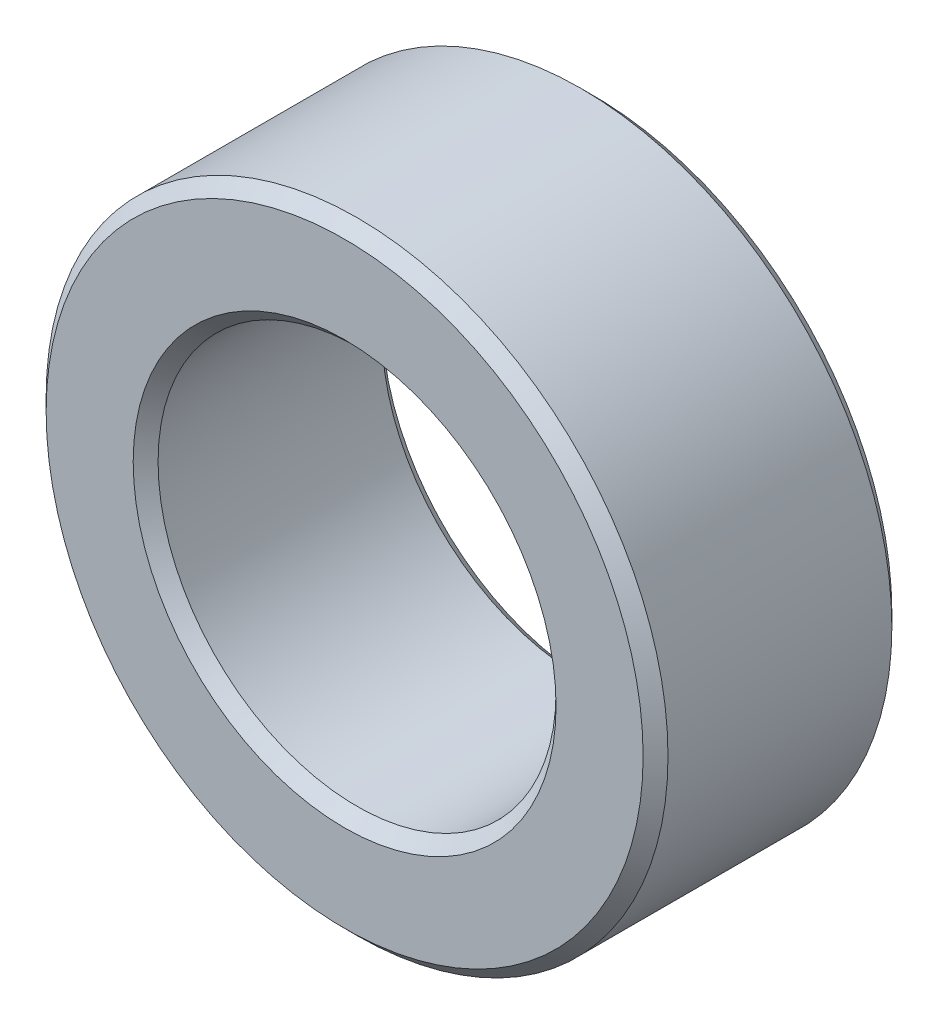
SolidWorks part; units mm, degrees
ref_plane "Front Plane" through (0, 0, 0) normal (0, 0, 1) x (1, 0, 0)
ref_plane "Top Plane" through (0, 0, 0) normal (0, 1, 0) x (1, 0, 0)
ref_plane "Right Plane" through (0, 0, 0) normal (1, 0, 0) x (0, 0, -1)
sketch "Sketch1" plane through (0, 0, 0) normal (0, 0, 1) x (1, 0, 0)
  circle A0 centre (0, 0) radius 5
  circle A1 centre (0, 0) radius 3.2
  dimension "D1" = 10
  dimension "D2" = 6.4
extrude "Boss-Extrude2" add sketch "Sketch1" along normal mid plane 4
chamfer "Chamfer3" distance 0.2 angle 45 4 edges at (5, 0, 2) (5, 0, -2) (3.2, 0, -2) (3.2, 0, 2)
